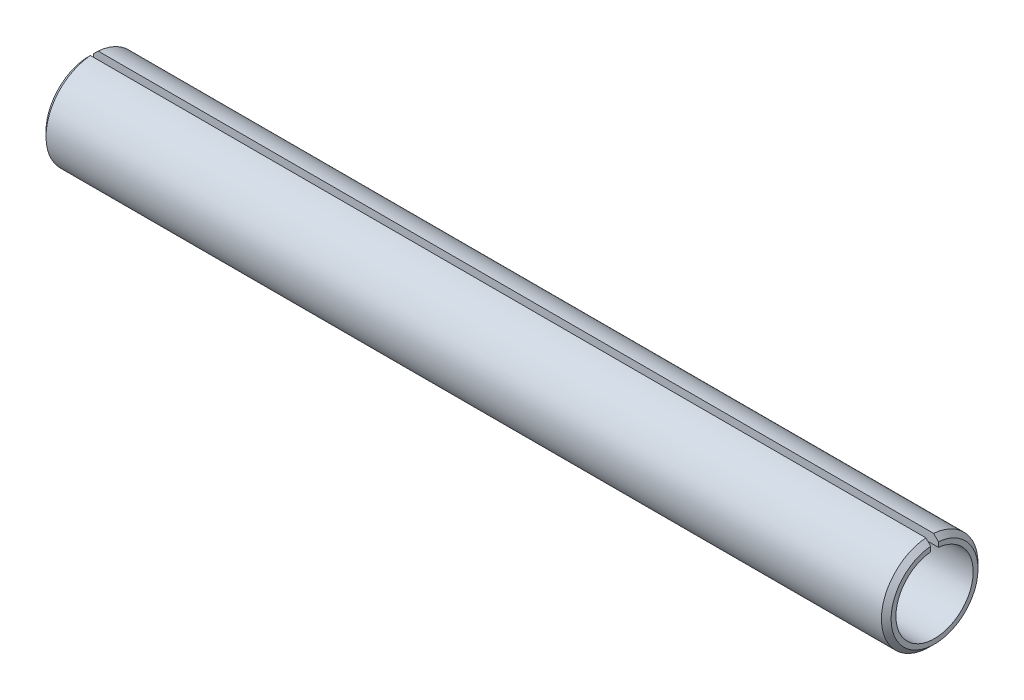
SolidWorks part; units mm, degrees
ref_plane "Plan1" through (0, 0, 0) normal (0, 0, 1) x (1, 0, 0)
ref_plane "Plan2" through (0, 0, 0) normal (0, 1, 0) x (1, 0, 0)
ref_plane "Plan3" through (0, 0, 0) normal (1, 0, 0) x (0, 0, -1)
sketch "Esquisse1" plane through (0, 0, 0) normal (0, 0, 1) x (1, 0, 0)
  line L0 (0, 1.6) -> (0, 1.8)
  line L1 (0, 1.6) -> (35, 1.6)
  line L2 (35, 1.6) -> (35, 1.8)
  line L3 (35, 1.8) -> (34.8, 2)
  line L4 (34.8, 2) -> (0.2, 2)
  line L5 (0.2, 2) -> (0, 1.8)
  line L6 (0, 0) -> (35, 0) construction
  dimension "D1" = 35
  dimension "D2" = 2
  dimension "D3" = 0.4
  dimension "D4" = 45
  dimension "D5" = 45
  dimension "D6" = 0.2
revolve "Base-Révolution" add sketch "Esquisse1" angle 360 about L6
sketch "Esquisse2" plane through (0, 0, 0) normal (1, 0, 0) x (0, 0, -1)
  line L0 (0, 0) -> (0, 2) construction
  line L1 (0.16, 1.9936) -> (0.16, 1.592)
  line L2 (-0.16, 1.9936) -> (-0.16, 1.592)
  circle A0 centre (0, 0) radius 2 construction
  circle A1 centre (0, 0) radius 1.6 construction
  arc A2 (0.16, 1.592) -> (-0.16, 1.592) centre (0, 0) ccw
  arc A3 (0.16, 1.9936) -> (-0.16, 1.9936) centre (0, 0) ccw
  dimension "D1" = 0.16
extrude "Enlèv. mat.-Extru.2" cut sketch "Esquisse2" along normal through all
equation "\"D6@Esquisse1\"=\"D2@Esquisse1\"/10"
equation "\"D1@Esquisse2\"=\"D3@Esquisse1\"/2.5"
